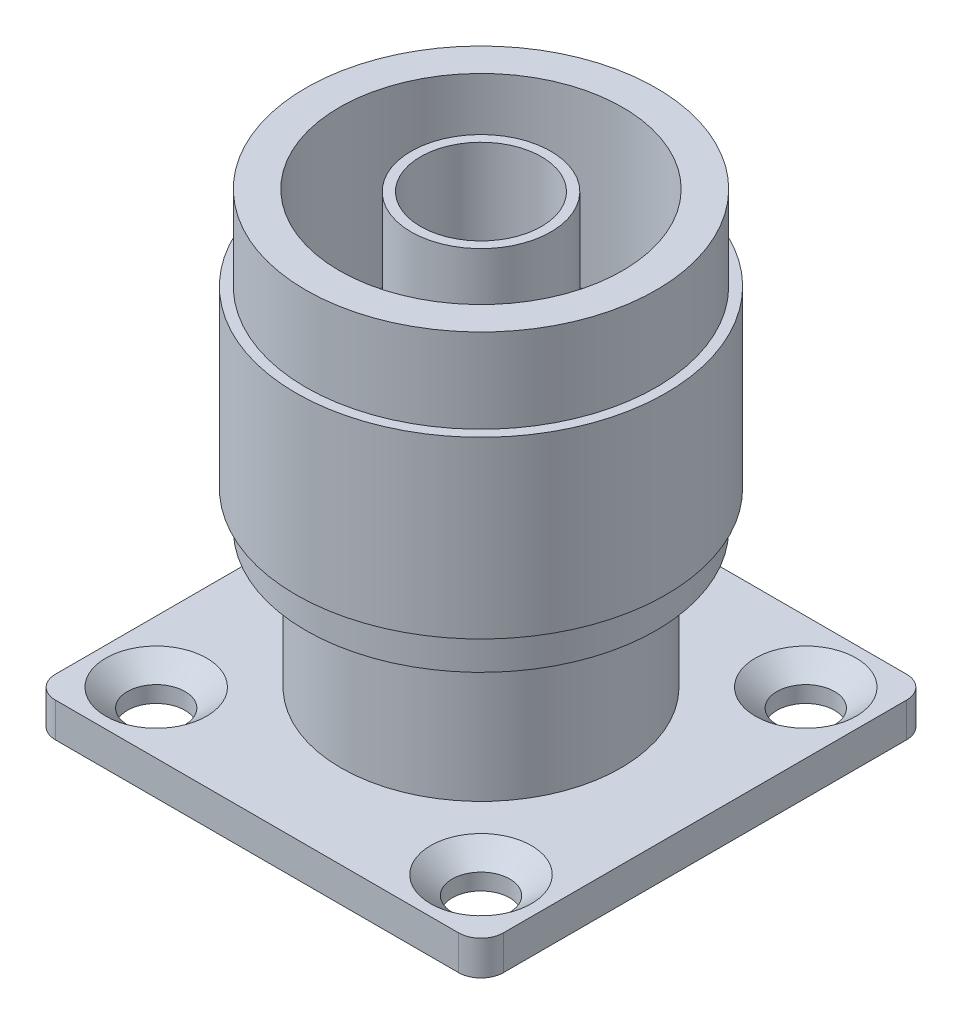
SolidWorks part; units mm, degrees
ref_plane "Front Plane" through (0, 0, 0) normal (0, 0, 1) x (1, 0, 0)
ref_plane "Top Plane" through (0, 0, 0) normal (0, 1, 0) x (1, 0, 0)
ref_plane "Right Plane" through (0, 0, 0) normal (1, 0, 0) x (0, 0, -1)
sketch "Sketch1" plane through (0, 0, 0) normal (0, 1, 0) x (1, 0, 0)
  line L1 (-12.7, 12.7) -> (12.7, 12.7)
  line L2 (-12.7, 12.7) -> (-12.7, -12.7)
  line L3 (-12.7, -12.7) -> (12.7, -12.7)
  line L4 (12.7, 12.7) -> (12.7, -12.7)
  line L5 (-12.7, 12.7) -> (12.7, -12.7) construction
  line L6 (-12.7, -12.7) -> (12.7, 12.7) construction
  point P0 (0, 0)
extrude "Boss-Extrude1" add sketch "Sketch1" along normal blind 1.9558
sketch "Sketch2" plane through (0, 1.9558, 0) normal (0, 1, 0) x (1, 0, 0)
  line L1 (-9.2075, -9.2075) -> (9.2075, -9.2075) construction
  line L2 (-9.2075, -9.2075) -> (-9.2075, 9.2075) construction
  line L3 (-9.2075, 9.2075) -> (9.2075, 9.2075) construction
  line L4 (9.2075, -9.2075) -> (9.2075, 9.2075) construction
  line L5 (-9.2075, -9.2075) -> (9.2075, 9.2075) construction
  line L6 (-9.2075, 9.2075) -> (9.2075, -9.2075) construction
  circle A0 centre (-9.2075, 9.2075) radius 1.59
  circle A1 centre (9.2075, 9.2075) radius 1.5875
  circle A2 centre (9.2075, -9.2075) radius 1.5875
  circle A3 centre (-9.2075, -9.2075) radius 1.5875
  point P0 (0, 0)
extrude "Cut-Extrude1" cut sketch "Sketch2" against normal blind 1.9558
fillet "Fillet1" radius 1.27 4 edges at (12.7, 0.9779, 12.7) (-12.7, 0.9779, 12.7) (12.7, 0.9779, -12.7) (-12.7, 0.9779, -12.7)
sketch "Sketch3" plane through (0, 1.9558, 0) normal (0, 1, 0) x (1, 0, 0)
  circle A0 centre (0, 0) radius 7.9375
extrude "Boss-Extrude2" add sketch "Sketch3" along normal blind 7.747
sketch "Sketch4" plane through (0, 9.7028, 0) normal (0, 1, 0) x (1, 0, 0)
  circle A0 centre (0, 0) radius 9.9314
extrude "Boss-Extrude3" add sketch "Sketch4" along normal blind 2.032
sketch "Sketch5" plane through (0, 11.7348, 0) normal (0, 1, 0) x (1, 0, 0)
  circle A0 centre (0, 0) radius 10.4902
extrude "Boss-Extrude4" add sketch "Sketch5" along normal blind 9.906
sketch "Sketch6" plane through (0, 21.6408, 0) normal (0, 1, 0) x (1, 0, 0)
  circle A0 centre (0, 0) radius 9.9314
extrude "Boss-Extrude5" add sketch "Sketch6" along normal blind 4.7752
sketch "Sketch7" plane through (0, 26.416, 0) normal (0, 1, 0) x (1, 0, 0)
  circle A0 centre (0, 0) radius 8.0264
extrude "Cut-Extrude2" cut sketch "Sketch7" against normal blind 9.779
sketch "Sketch9" plane through (0, 16.637, 0) normal (0, 1, 0) x (1, 0, 0)
  circle A0 centre (0, 0) radius 3.9624
extrude "Boss-Extrude7" add sketch "Sketch9" along normal blind 9.652
sketch "Sketch10" plane through (0, 26.289, 0) normal (0, 1, 0) x (1, 0, 0)
  circle A0 centre (0, 0) radius 3.429
extrude "Cut-Extrude3" cut sketch "Sketch10" against normal blind 9.652
sketch "Sketch12" plane through (0, 0, 0) normal (0, -1, 0) x (1, 0, 0)
  circle A0 centre (0, 0) radius 6.0198
extrude "Boss-Extrude8" add sketch "Sketch12" along normal blind 0.254
sketch "Sketch13" plane through (0, -0.254, 0) normal (0, -1, 0) x (1, 0, 0)
  circle A0 centre (0, 0) radius 5.08
extrude "Cut-Extrude5" cut sketch "Sketch13" against normal blind 0.254
sketch "Sketch14" plane through (0, 0, 0) normal (0, -1, 0) x (1, 0, 0)
  circle A0 centre (0, 0) radius 1.651
extrude "Cut-Extrude6" cut sketch "Sketch14" against normal through all
hole_wizard "CSK for #4 Flat Head Machine Screw (100)1" positions "Sketch15" profile "Sketch16" countersink size "#4" standard "ANSI Inch"
sketch "Sketch15" plane through (0, 1.9558, 0) normal (0, 1, 0) x (1, 0, 0)
  point P0 (-9.2075, 9.2075)
  point P3 (9.2075, 9.2075)
  point P6 (9.2075, -9.2075)
  point P9 (-9.2075, -9.2075)
sketch "Sketch16" plane through (-9.2075, 1.9558, -9.2075) normal (1, 0, 0) x (0, 0, 1)
  line L0 (0, 0) -> (0, 2.2098)
  line L1 (0, 2.2098) -> (1.6319, 2.2098)
  line L2 (1.6319, 2.2098) -> (1.6319, 1.0284)
  line L3 (1.6319, 1.0284) -> (2.8575, 0)
  line L5 (2.8575, 0) -> (0, 0)
  line L6 (-1.6319, 1.0284) -> (-2.8575, 0) construction
  line L11 (0, -6.35) -> (0, 107.95) construction
  dimension "Thru Hole Dia." = 3.2639
  dimension "Thru Hole Depth" = 2.2098
  dimension "Near C'Sink Dia." = 5.715
  dimension "Near C'Sink Angle" = 100
